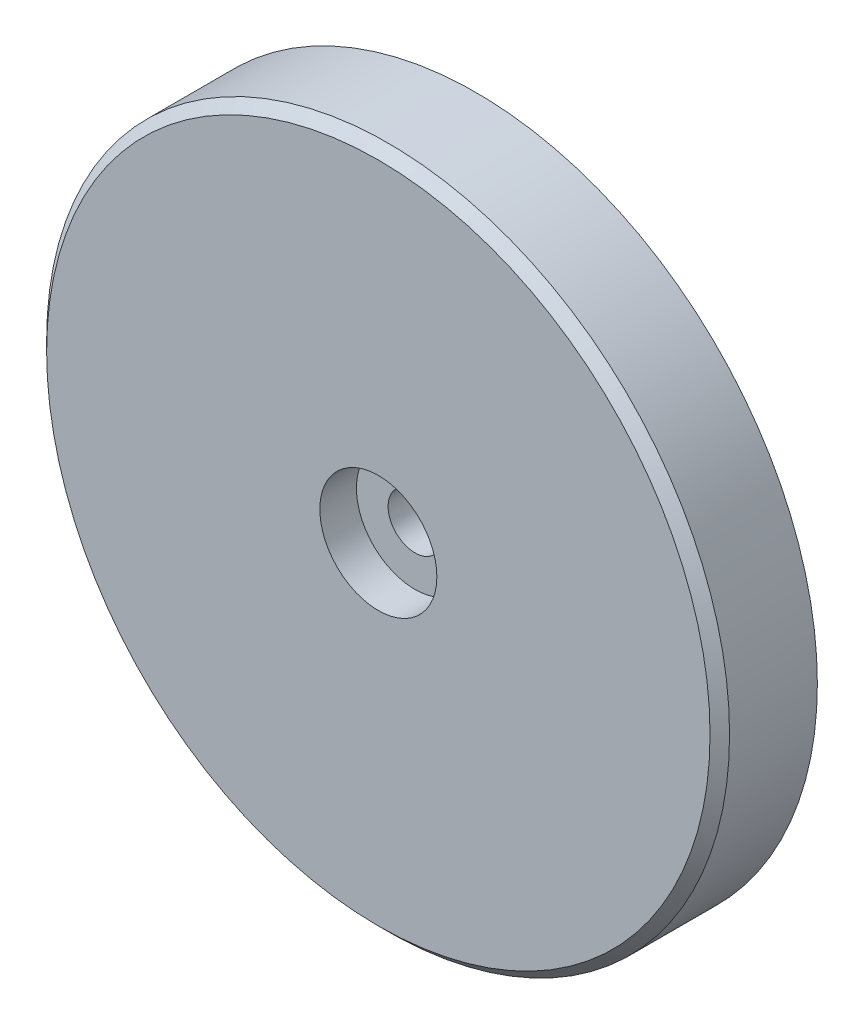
SolidWorks part; units mm, degrees
ref_plane "Face" through (0, 0, 0) normal (0, 0, 1) x (1, 0, 0)
ref_plane "Dessus" through (0, 0, 0) normal (0, 1, 0) x (1, 0, 0)
ref_plane "Droite" through (0, 0, 0) normal (1, 0, 0) x (0, 0, -1)
sketch "Esquisse1" plane through (0, 0, 0) normal (0, 0, 1) x (1, 0, 0)
  circle A0 centre (0, 0) radius 70
  dimension "D1" = 140
extrude "Extrusion1" add sketch "Esquisse1" along normal blind 20
chamfer "Chanfrein1" distance 2 angle 45 1 edges at (70, 0, 20)
sketch "Esquisse6" plane through (0, 0, 0) normal (0, 0, -1) x (-1, 0, 0)
  circle A0 centre (0, 0) radius 20
  dimension "D1" = 40
extrude "Extrusion2" add sketch "Esquisse6" along normal blind 5
chamfer "Chanfrein2" distance 1 angle 45 1 edges at (0, 20, -5)
hole_wizard "Chambrage pour vis à tête ronde bombée M101" positions "Esquisse5" profile "Esquisse4" counterbore size "M10" standard "Ansi Métrique"
sketch "Esquisse5" plane through (0, 0, 20) normal (0, 0, 1) x (1, 0, 0)
  point P0 (0, 0)
sketch "Esquisse4" plane through (0, 0, 20) normal (1, 0, 0) x (0, -1, 0)
  line L0 (0, 0) -> (0, 25)
  line L1 (0, 25) -> (5.5, 25)
  line L3 (5.5, 25) -> (5.5, 7.5)
  line L4 (5.5, 7.5) -> (12, 7.5)
  line L5 (12, 7.5) -> (12, 0)
  line L7 (12, 0) -> (0, 0)
  line L11 (0, -6.35) -> (0, 107.95) construction
  dimension "Diamètre du perçage jusqu'au prochain" = 11
  dimension "Profondeur du perçage jusqu'au prochain" = 25
  dimension "Diamètre du chambrage" = 24
  dimension "Profondeur du chambrage" = 7.5
